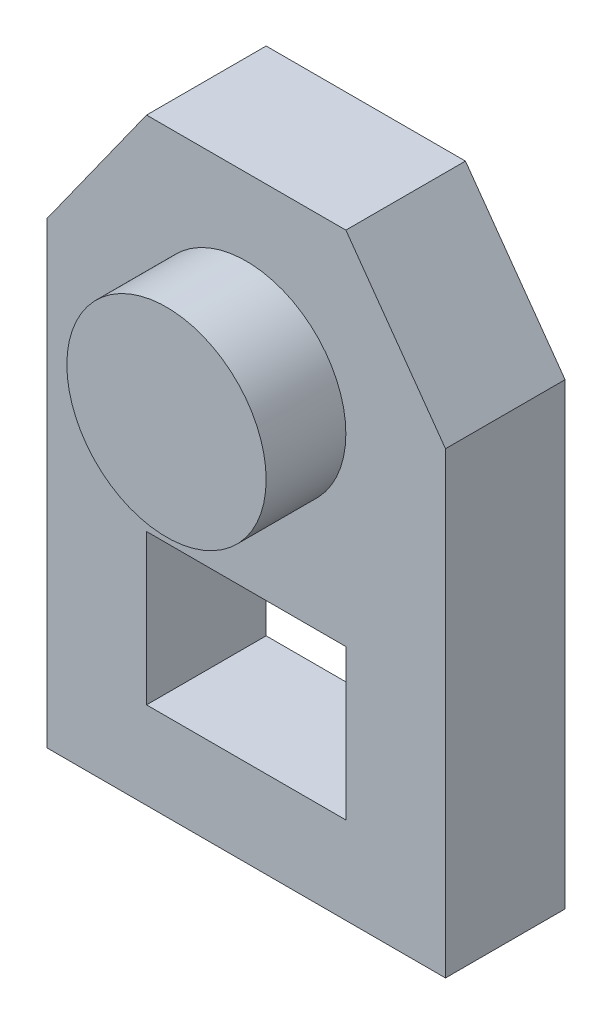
SolidWorks part; units mm, degrees
ref_plane "前视基准面" through (0, 0, 0) normal (0, 0, 1) x (1, 0, 0)
ref_plane "上视基准面" through (0, 0, 0) normal (0, 1, 0) x (1, 0, 0)
ref_plane "右视基准面" through (0, 0, 0) normal (1, 0, 0) x (0, 0, -1)
sketch "草图1" plane through (0, 0, 0) normal (0, 0, 1) x (1, 0, 0)
  line L0 (0, -26.8761) -> (0, 73.501) construction
  line L1 (10, 60) -> (-10, 60)
  line L2 (-10, 60) -> (-20, 46)
  line L3 (-20, 46) -> (-20, 0)
  line L4 (-20, 0) -> (20, 0)
  line L5 (20, 46) -> (20, 0)
  line L6 (10, 60) -> (20, 46)
  point P9 (0, 0)
  point P11 (0, 60)
  dimension "D1" = 10
  dimension "D2" = 20
  dimension "D3" = 46
  dimension "D4" = 60
extrude "凸台-拉伸1" add sketch "草图1" along normal blind 12
sketch "草图2" plane through (0, 0, 12) normal (0, 0, 1) x (1, 0, 0)
  line L0 (0, -1.1644) -> (0, 61.4244) construction
  line L1 (-14.0566, 42.3115) -> (13.7229, 42.3115) construction
  circle A0 centre (0, 42.3115) radius 10
  dimension "D1" = 20
sketch "草图3" plane through (0, 0, 12) normal (0, 0, 1) x (1, 0, 0)
  line L0 (0, 55.5591) -> (0, 6.2092) construction
  line L1 (0, -1.1644) -> (0, 61.4244) construction
  line L2 (-10, 23.8052) -> (10, 23.8052)
  line L3 (10, 23.8052) -> (10, 8.7373)
  line L4 (10, 8.7373) -> (-10, 8.7373)
  line L5 (-10, 23.8052) -> (-10, 8.7373)
  point P9 (0, 8.7373)
  point P10 (0, 23.8052)
extrude "凸台-拉伸2" add sketch "草图2" along normal blind 8
extrude "切除-拉伸1" cut sketch "草图3" against normal blind 18
